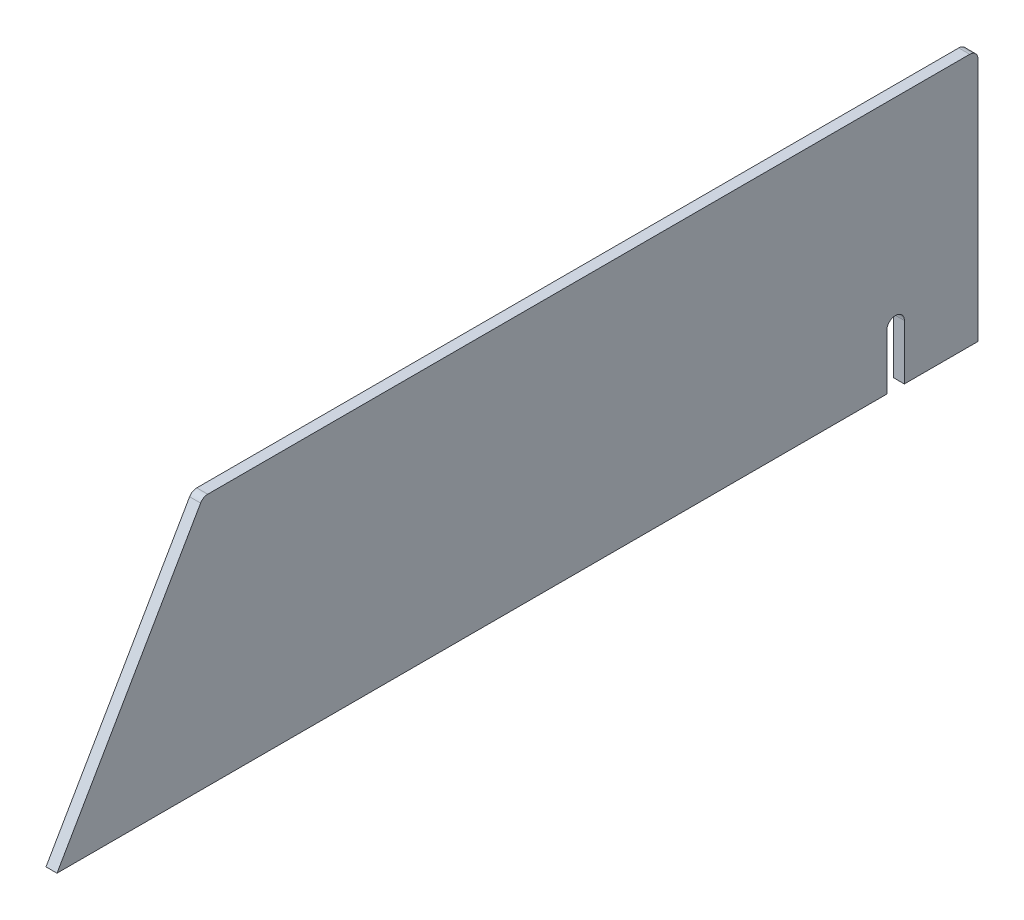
SolidWorks part; units mm, degrees
ref_plane "Front Plane" through (0, 0, 0) normal (0, 0, 1) x (1, 0, 0)
ref_plane "Top Plane" through (0, 0, 0) normal (0, 1, 0) x (1, 0, 0)
ref_plane "Right Plane" through (0, 0, 0) normal (1, 0, 0) x (0, 0, -1)
sketch "Sketch1" plane through (0, 0, 0) normal (1, 0, 0) x (0, 0, -1)
  line L0 (0, 0) -> (55, 0)
  line L1 (55, 0) -> (55, -46)
  line L2 (55, -46) -> (-112.5581, -46)
  line L3 (-112.5581, -46) -> (-86, 0)
  line L4 (-86, 0) -> (0, 0)
  dimension "D1" = 46
  dimension "D2" = 55
  dimension "D3" = 86
  dimension "D4" = 60
extrude "Boss-Extrude1" add sketch "Sketch1" along normal blind 2
fillet "Fillet1" radius 1.5 2 edges at (1, 0, 86) (1, 0, -55)
sketch "Sketch4" [suppressed] plane through (2, 0, 0) normal (1, 0, 0) x (0, 0, -1)
  line L1 (55, -46) -> (47, -46)
  line L2 (55, -46) -> (55, -38)
  line L3 (55, -38) -> (47, -38)
  line L4 (47, -46) -> (47, -38)
  dimension "D1" = 8
  dimension "D2" = 8
extrude "Cut-Extrude1" [suppressed] cut sketch "Sketch4" against normal through all
sketch "Sketch7" plane through (2, 0, 0) normal (1, 0, 0) x (0, 0, -1)
  line L0 (40, -36) -> (40, -48.8606) construction
  line L1 (41.6, -36) -> (41.6, -48.8606)
  line L2 (38.4, -36) -> (38.4, -48.8606)
  line L3 (-112.5581, -46) -> (55, -46) construction
  line L4 (55, -46) -> (55, -1.5) construction
  arc A0 (41.6, -36) -> (38.4, -36) centre (40, -36) ccw
  arc A1 (38.4, -48.8606) -> (41.6, -48.8606) centre (40, -48.8606) ccw
  point P2 (40, -42.4303)
  dimension "D1" = 1.6
  dimension "D2" = 10
  dimension "D3" = 15
  dimension "D4" = 12.8606
extrude "Cut-Extrude3" cut sketch "Sketch7" against normal through all
